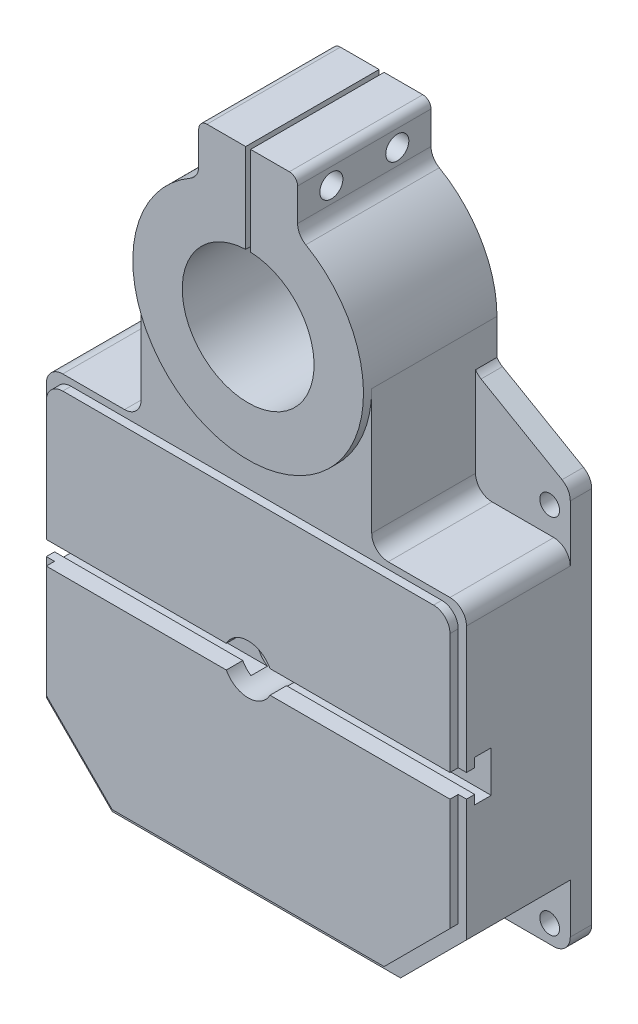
SolidWorks part; units mm, degrees
ref_plane "前视基准面" through (0, 0, 0) normal (0, 0, 1) x (1, 0, 0)
ref_plane "上视基准面" through (0, 0, 0) normal (0, 1, 0) x (1, 0, 0)
ref_plane "右视基准面" through (0, 0, 0) normal (1, 0, 0) x (0, 0, -1)
sketch "草图1" plane through (0, 0, 0) normal (0, 0, 1) x (1, 0, 0)
  line L0 (0, 0) -> (0, 180) construction
  line L1 (0, 0) -> (127.5, 0) construction
  line L2 (127.5, 118.2265) -> (127.5, -111)
  line L3 (117.5, -121) -> (-117.5, -121)
  line L4 (0, 0) -> (-115, 0) construction
  line L5 (-115, 0) -> (-115, -110) construction
  line L6 (0, 180) -> (0, 274) construction
  line L7 (0, 274) -> (25, 274)
  line L8 (0, 274) -> (-25, 274)
  line L9 (-30, 269) -> (-30, 249.282)
  line L10 (30, 269) -> (30, 249.282)
  line L11 (-127.5, -111) -> (-127.5, 118.2265)
  line L12 (-122.5, 126.8868) -> (-73.3662, 155.2542)
  line L13 (122.5, 126.8868) -> (73.3662, 155.2542)
  circle A0 centre (0, 0) radius 15
  circle A1 centre (0, 180) radius 40
  arc A2 (68.5704, 165.9251) -> (35, 240.6218) centre (0, 180) ccw
  circle A3 centre (-115, -110) radius 6
  circle A4 centre (-115, 110) radius 6
  circle A5 centre (115, -110) radius 6
  circle A6 centre (115, 110) radius 6
  arc A7 (-122.5, 126.8868) -> (-127.5, 118.2265) centre (-117.5, 118.2265) ccw
  arc A8 (122.5, 126.8868) -> (127.5, 118.2265) centre (117.5, 118.2265) cw
  arc A9 (127.5, -111) -> (117.5, -121) centre (117.5, -111) cw
  arc A10 (-127.5, -111) -> (-117.5, -121) centre (-117.5, -111) ccw
  arc A11 (-35, 240.6218) -> (-68.5704, 165.9251) centre (0, 180) ccw
  arc A12 (-30, 249.282) -> (-35, 240.6218) centre (-40, 249.282) cw
  arc A13 (30, 249.282) -> (35, 240.6218) centre (40, 249.282) ccw
  arc A14 (68.5704, 165.9251) -> (73.3662, 155.2542) centre (78.3662, 163.9144) ccw
  arc A15 (-73.3662, 155.2542) -> (-68.5704, 165.9251) centre (-78.3662, 163.9144) ccw
  arc A16 (25, 274) -> (30, 269) centre (25, 269) cw
  arc A17 (-30, 269) -> (-25, 274) centre (-25, 269) cw
  point P29 (-127.5, 124)
  dimension "D1" = 10
  dimension "D2" = 10
  dimension "D3" = 5
extrude "凸台-拉伸2" add sketch "草图1" along normal blind 13
sketch "草图2" plane through (0, 0, 13) normal (0, 0, 1) x (1, 0, 0)
  line L0 (127.5, -111) -> (127.5, 118.2265) construction
  line L1 (-127.5, 118.2265) -> (-127.5, -111) construction
  line L2 (-117.5, -121) -> (117.5, -121) construction
  line L3 (127.5, -81) -> (127.5, 84)
  line L4 (-127.5, 84) -> (-127.5, -81)
  line L5 (-87.5, -121) -> (87.5, -121)
  line L6 (0, 0) -> (0, 94) construction
  line L7 (-117.5, 94) -> (-80, 94)
  line L8 (-127.5, -81) -> (-87.5, -121)
  line L9 (87.5, -121) -> (127.5, -81)
  line L10 (70, 180) -> (70, 104)
  line L11 (-70, 180) -> (-70, 104)
  line L12 (30, 249.282) -> (30, 269) construction
  line L13 (-30, 269) -> (-30, 249.282) construction
  line L14 (25, 274) -> (-25, 274) construction
  line L15 (30, 249.282) -> (30, 269)
  line L16 (-30, 269) -> (-30, 249.282)
  line L17 (25, 274) -> (-25, 274)
  line L18 (80, 94) -> (117.5, 94)
  circle A0 centre (0, 0) radius 15 construction
  circle A1 centre (0, 180) radius 40 construction
  circle A2 centre (0, 0) radius 15
  circle A3 centre (0, 180) radius 40
  arc A4 (117.5, 94) -> (127.5, 84) centre (117.5, 84) cw
  arc A5 (-127.5, 84) -> (-117.5, 94) centre (-117.5, 84) cw
  arc A6 (-35, 240.6218) -> (-70, 180) centre (0, 180) ccw
  arc A7 (30, 249.282) -> (35, 240.6218) centre (40, 249.282) ccw construction
  arc A8 (30, 269) -> (25, 274) centre (25, 269) ccw construction
  arc A9 (-35, 240.6218) -> (-30, 249.282) centre (-40, 249.282) ccw construction
  arc A10 (-25, 274) -> (-30, 269) centre (-25, 269) ccw construction
  arc A11 (30, 249.282) -> (35, 240.6218) centre (40, 249.282) ccw
  arc A12 (30, 269) -> (25, 274) centre (25, 269) ccw
  arc A13 (-35, 240.6218) -> (-30, 249.282) centre (-40, 249.282) ccw
  arc A14 (-25, 274) -> (-30, 269) centre (-25, 269) ccw
  arc A15 (70, 180) -> (35, 240.6218) centre (0, 180) ccw
  arc A16 (70, 104) -> (80, 94) centre (80, 104) ccw
  arc A17 (-70, 104) -> (-80, 94) centre (-80, 104) cw
  point P21 (-127.5, -121)
  point P24 (127.5, -121)
  dimension "D1" = 10
  dimension "D2" = 10
extrude "凸台-拉伸3" add sketch "草图2" along normal blind 63
sketch "草图3" plane through (0, 0, 13) normal (0, 0, -1) x (-1, 0, 0)
  line L0 (-70, 180) -> (-70, 158.4365) construction
  line L1 (70, 158.4365) -> (70, 180) construction
  line L2 (-70, 180) -> (-70, 158.4365)
  line L3 (70, 158.4365) -> (70, 180)
  arc A0 (-70, 158.4365) -> (-68.5704, 165.9251) centre (-78.3662, 163.9144) ccw construction
  arc A1 (-70, 180) -> (-68.5704, 165.9251) centre (0, 180) ccw construction
  arc A2 (68.5704, 165.9251) -> (70, 180) centre (0, 180) ccw construction
  arc A3 (68.5704, 165.9251) -> (70, 158.4365) centre (78.3662, 163.9144) ccw construction
  arc A4 (-70, 158.4365) -> (-68.5704, 165.9251) centre (-78.3662, 163.9144) ccw
  arc A5 (-70, 180) -> (-68.5704, 165.9251) centre (0, 180) ccw
  arc A6 (68.5704, 165.9251) -> (70, 180) centre (0, 180) ccw
  arc A7 (68.5704, 165.9251) -> (70, 158.4365) centre (78.3662, 163.9144) ccw
extrude "凸台-拉伸4" add sketch "草图3" along normal blind 13
sketch "草图5" plane through (0, 0, 76) normal (0, 0, 1) x (1, 0, 0)
  line L0 (0, 0) -> (122.5, 0) construction
  line L1 (122.5, 80) -> (122.5, -75)
  line L2 (82.5, -115) -> (-82.5, -115)
  line L3 (-122.5, -75) -> (-122.5, 80)
  line L4 (-112.5, 90) -> (112.5, 90)
  line L5 (-82.5, -115) -> (-122.5, -75)
  line L6 (122.5, -75) -> (82.5, -115)
  line L7 (30, 249.282) -> (30, 269) construction
  line L8 (-30, 269) -> (-30, 249.282) construction
  line L9 (25, 274) -> (-25, 274) construction
  line L10 (30, 249.282) -> (30, 269)
  line L11 (-30, 269) -> (-30, 249.282)
  line L12 (25, 274) -> (-25, 274)
  arc A0 (112.5, 90) -> (122.5, 80) centre (112.5, 80) cw
  arc A1 (-112.5, 90) -> (-122.5, 80) centre (-112.5, 80) ccw
  arc A2 (30, 249.282) -> (35, 240.6218) centre (40, 249.282) ccw construction
  arc A3 (30, 269) -> (25, 274) centre (25, 269) ccw construction
  arc A4 (-35, 240.6218) -> (-30, 249.282) centre (-40, 249.282) ccw construction
  arc A5 (-25, 274) -> (-30, 269) centre (-25, 269) ccw construction
  circle A6 centre (0, 180) radius 40 construction
  circle A7 centre (0, 0) radius 15 construction
  arc A8 (30, 249.282) -> (35, 240.6218) centre (40, 249.282) ccw
  arc A9 (30, 269) -> (25, 274) centre (25, 269) ccw
  arc A10 (-35, 240.6218) -> (-30, 249.282) centre (-40, 249.282) ccw
  arc A11 (-25, 274) -> (-30, 269) centre (-25, 269) ccw
  circle A12 centre (0, 180) radius 40
  circle A13 centre (0, 0) radius 15
  arc A14 (-35, 240.6218) -> (35, 240.6218) centre (0, 180) ccw
  point P3 (122.5, -115)
  point P5 (-122.5, -115)
  dimension "D1" = 10
extrude "凸台-拉伸5" add sketch "草图5" along normal blind 5
sketch "草图6" plane through (0, 0, 0) normal (0, 0, -1) x (-1, 0, 0)
  line L0 (0, 0) -> (115.5, 0) construction
  line L1 (115.5, 72) -> (115.5, -69)
  line L2 (75.5, -109) -> (-75.5, -109)
  line L3 (-115.5, -69) -> (-115.5, 72)
  line L4 (-105.5, 82) -> (-69, 82)
  line L5 (-75.5, -109) -> (-115.5, -69)
  line L6 (115.5, -69) -> (75.5, -109)
  line L7 (0, 82) -> (0, 127) construction
  line L8 (0, 127) -> (49, 127)
  line L9 (0, 127) -> (-49, 127)
  line L10 (-59, 117) -> (-59, 92)
  line L11 (59, 117) -> (59, 92)
  line L12 (69, 82) -> (105.5, 82)
  arc A0 (105.5, 82) -> (115.5, 72) centre (105.5, 72) cw
  arc A1 (-115.5, 72) -> (-105.5, 82) centre (-105.5, 72) cw
  arc A2 (-59, 92) -> (-69, 82) centre (-69, 92) cw
  arc A3 (59, 92) -> (69, 82) centre (69, 92) ccw
  arc A4 (49, 127) -> (59, 117) centre (49, 117) cw
  arc A5 (-49, 127) -> (-59, 117) centre (-49, 117) ccw
  point P4 (115.5, -109)
  point P5 (-115.5, -109)
  dimension "D1" = 10
  dimension "D2" = 10
extrude "切除-拉伸1" cut sketch "草图6" against normal blind 58
sketch "草图7" plane through (0, 0, 58) normal (0, 0, -1) x (-1, 0, 0)
  line L1 (115.5, 22.5) -> (-115.5, 22.5)
  line L2 (115.5, 22.5) -> (115.5, -22.5)
  line L3 (115.5, -22.5) -> (-115.5, -22.5)
  line L4 (-115.5, 22.5) -> (-115.5, -22.5)
  line L5 (115.5, 22.5) -> (-115.5, -22.5) construction
  line L6 (115.5, -22.5) -> (-115.5, 22.5) construction
  circle A0 centre (0, 0) radius 15 construction
  circle A1 centre (0, 0) radius 15
  point P0 (0, 0)
  dimension "D1" = 45
  dimension "D2" = 231
extrude "凸台-拉伸6" add sketch "草图7" along normal blind 17
sketch "草图8" plane through (-127.5, 0, 0) normal (-1, 0, 0) x (0, 0, 1)
  line L0 (0, 0) -> (61, 0) construction
  line L1 (61, 12.5) -> (61, -12.5)
  line L2 (61, -12.5) -> (71, -12.5)
  line L3 (71, -12.5) -> (71, -7)
  line L4 (71, -7) -> (82, -7)
  line L5 (61, 12.5) -> (71, 12.5)
  line L6 (71, 12.5) -> (71, 7)
  line L7 (71, 7) -> (82, 7)
  line L8 (82, 7) -> (82, -7)
extrude "切除-拉伸2" cut sketch "草图8" against normal blind 255
sketch "草图9" plane through (0, 274, 0) normal (0, 1, 0) x (1, 0, 0)
  line L0 (0, 0) -> (0, -81) construction
  line L1 (25, 0) -> (-25, 0) construction
  line L3 (-1.5, -95.687) -> (1.5, -95.687)
  line L4 (-1.5, -95.687) -> (-1.5, 14.687)
  line L5 (-1.5, 14.687) -> (1.5, 14.687)
  line L6 (1.5, -95.687) -> (1.5, 14.687)
  line L7 (-1.5, -95.687) -> (1.5, 14.687) construction
  line L8 (-1.5, 14.687) -> (1.5, -95.687) construction
  point P4 (0, -40.5)
  dimension "D1" = 3
extrude "切除-拉伸3" cut sketch "草图9" against normal blind 70
sketch "草图10" plane through (30, 0, 0) normal (1, 0, 0) x (0, 0, -1)
  line L0 (-81, 274) -> (0, 274) construction
  line L1 (-81, 249.282) -> (-81, 269) construction
  line L2 (0, 249.282) -> (0, 269) construction
  circle A0 centre (-60.5, 259) radius 7
  circle A1 centre (-20.5, 259) radius 7
  dimension "D1" = 15
  dimension "D2" = 15
  dimension "D3" = 20.5
  dimension "D4" = 20.5
extrude "切除-拉伸4" cut sketch "草图10" against normal blind 10
sketch "草图11" plane through (20, 0, 0) normal (1, 0, 0) x (0, 0, -1)
  circle A0 centre (-60.5, 259) radius 4.5
  circle A1 centre (-20.5, 259) radius 4.5
extrude "切除-拉伸5" cut sketch "草图11" against normal up to surface (50 mm away)
sketch "草图12" plane through (-127.5, 0, 0) normal (-1, 0, 0) x (0, 0, 1)
  line L0 (0, 118.2265) -> (0, -111) construction
  line L1 (76, 94) -> (13, 94) construction
  circle A0 centre (34, 59) radius 11
  dimension "D1" = 34
  dimension "D2" = 35
extrude "切除-拉伸7" cut sketch "草图12" against normal blind 12
sketch "草图13" plane through (0, -121, 0) normal (0, -1, 0) x (1, 0, 0)
  line L0 (-117.5, 0) -> (117.5, 0) construction
  circle A0 centre (32, 44.5) radius 10
  circle A1 centre (-47, 44.5) radius 2.5
  circle A2 centre (47, 44.5) radius 2.5
  point P8 (0, 0)
  dimension "D1" = 44.5
  dimension "D2" = 44.5
  dimension "D3" = 44.5
  dimension "D4" = 32
  dimension "D5" = 47
  dimension "D6" = 94
extrude "切除-拉伸8" cut sketch "草图13" against normal blind 12
